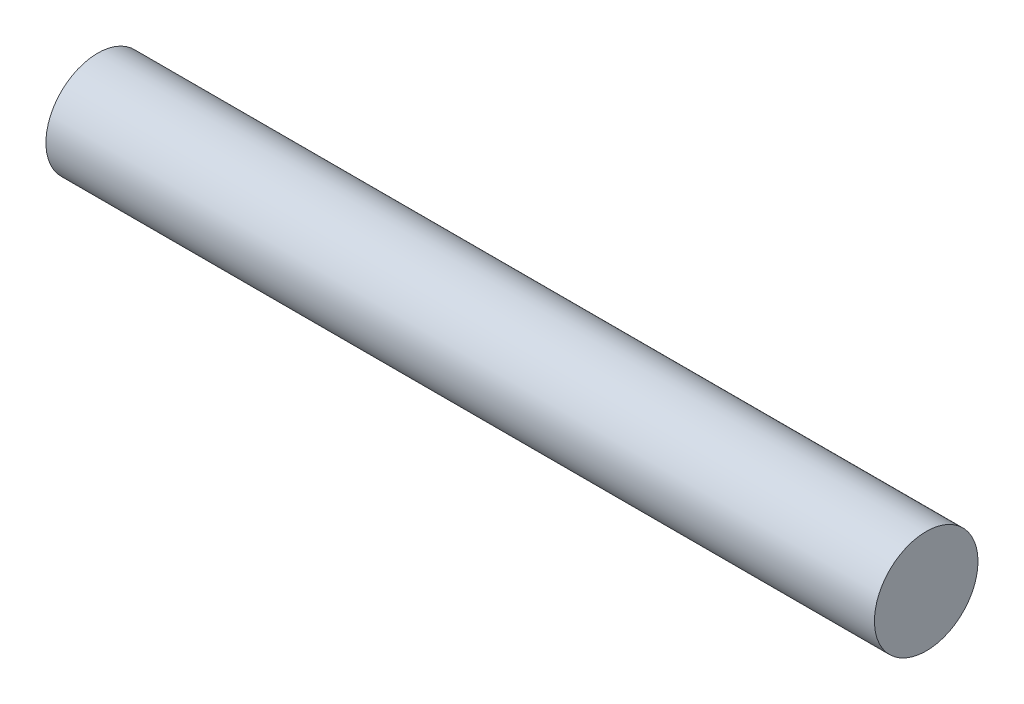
SolidWorks part; units mm, degrees
ref_plane "Alzado" through (0, 0, 0) normal (0, 0, 1) x (1, 0, 0)
ref_plane "Planta" through (0, 0, 0) normal (0, 1, 0) x (1, 0, 0)
ref_plane "Vista lateral" through (0, 0, 0) normal (1, 0, 0) x (0, 0, -1)
sketch "Croquis1" plane through (0, 0, 0) normal (1, 0, 0) x (0, 0, -1)
  circle A0 centre (0, 0) radius 1
  dimension "D1" = 2
extrude "Saliente-Extruir1" add sketch "Croquis1" along normal blind 16
